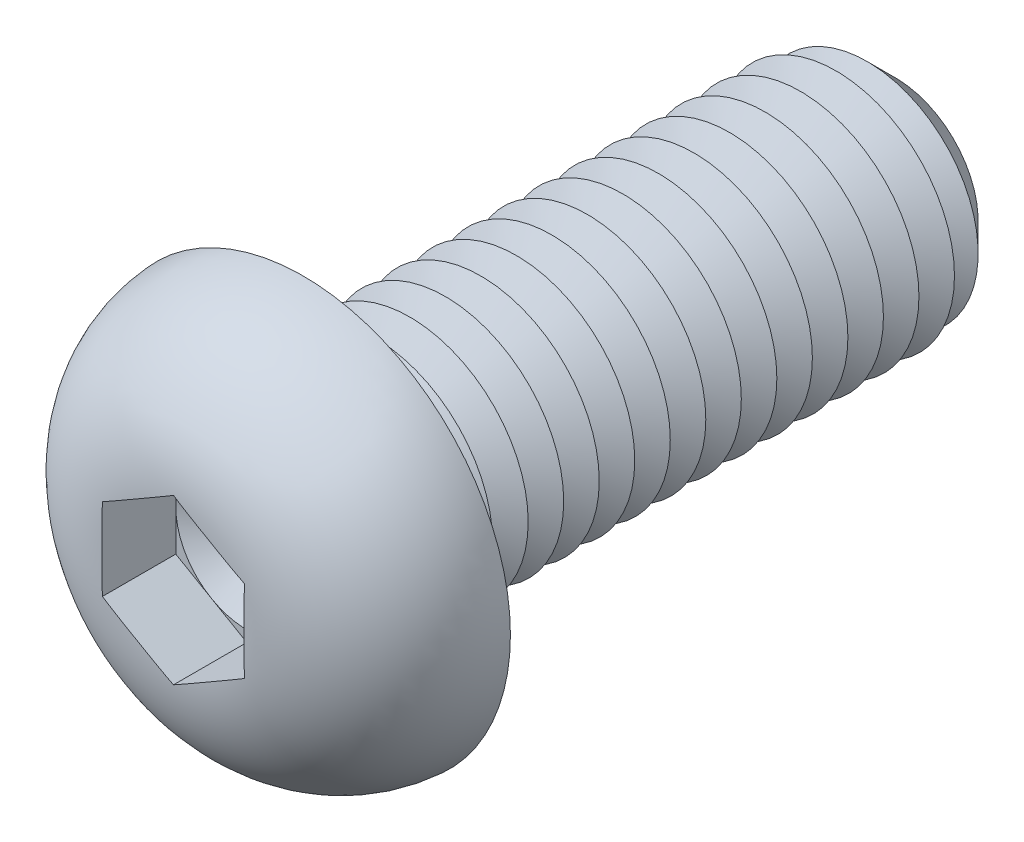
SolidWorks part; units mm, degrees
ref_plane "Front Plane" through (0, 0, 0) normal (0, 0, 1) x (1, 0, 0)
ref_plane "Top Plane" through (0, 0, 0) normal (0, 1, 0) x (1, 0, 0)
ref_plane "Right Plane" through (0, 0, 0) normal (1, 0, 0) x (0, 0, -1)
sketch "Sketch1" plane through (0, 0, 0) normal (1, 0, 0) x (0, 0, -1)
  line L0 (-47.9342, 0) -> (60.3146, 0) construction
sketch "Sketch2" plane through (0, 0, 0) normal (1, 0, 0) x (0, 0, -1)
  line L0 (0, 0) -> (-5.5, 0)
  line L1 (-47.9342, 0) -> (60.3146, 0) construction
  line L2 (-5.5, 0) -> (-5.5, 2.9578)
  line L3 (0, 8.75) -> (0, 0)
  arc A0 (-5.5, 2.9578) -> (0, 8.75) centre (0.3, 2.9578) cw
  dimension "D1" = 5.8
  dimension "D2" = 5.5
  dimension "D3" = 8.75
revolve "Revolve1" add sketch "Sketch2" angle 360 about L0
sketch "Sketch3" plane through (0, 0, 5.5) normal (0, 0, 1) x (1, 0, 0)
  line L1 (0, 3.4641) -> (-3, 1.7321)
  line L2 (-3, 1.7321) -> (-3, -1.7321)
  line L3 (-3, -1.7321) -> (0, -3.4641)
  line L4 (0, -3.4641) -> (3, -1.7321)
  line L5 (3, -1.7321) -> (3, 1.7321)
  line L6 (3, 1.7321) -> (0, 3.4641)
  circle A0 centre (0, 0) radius 3 construction
  dimension "D1" = 6
extrude "Cut-Extrude1" cut sketch "Sketch3" against normal blind 3.12
sketch "Sketch4" plane through (0, 0, 0) normal (0, 0, -1) x (-1, 0, 0)
  circle A0 centre (0, 0) radius 5
  dimension "D1" = 10
extrude "Boss-Extrude1" add sketch "Sketch4" along normal blind 25
chamfer "Chamfer1" distance 1.5 angle 45 1 edges at (-5, 0, -25)
sketch "Sketch5" plane through (0, 0, 0) normal (1, 0, 0) x (0, 0, -1)
  line L0 (1.5, 5) -> (3, 5)
  line L1 (23.5, 5) -> (0, 5) construction
  line L2 (3, 5) -> (2.25, 3.701)
  line L3 (2.25, 3.701) -> (1.5, 5)
  line L4 (0, -8.75) -> (0, 8.75) construction
  line L5 (23.5, 5) -> (0, 5) construction
  dimension "D1" = 1.5
  dimension "D2" = 1.5
revolve "Cut-Revolve1" cut sketch "Sketch5" angle 360 about L0
pattern_linear "LPattern1" count 15 spacing 1.5 along (0, 0, -1) of "Cut-Revolve1"
fillet "Fillet2" radius 0.6 1 edges at (5, 0, 0)
sketch "Sketch6" plane through (0, 0, 2.38) normal (0, 0, 1) x (1, 0, 0)
  line L0 (0, -3.4641) -> (3, -1.7321) construction
  circle A0 centre (0, 0) radius 3
extrude "Cut-Extrude2" cut sketch "Sketch6" against normal through all draft 60
